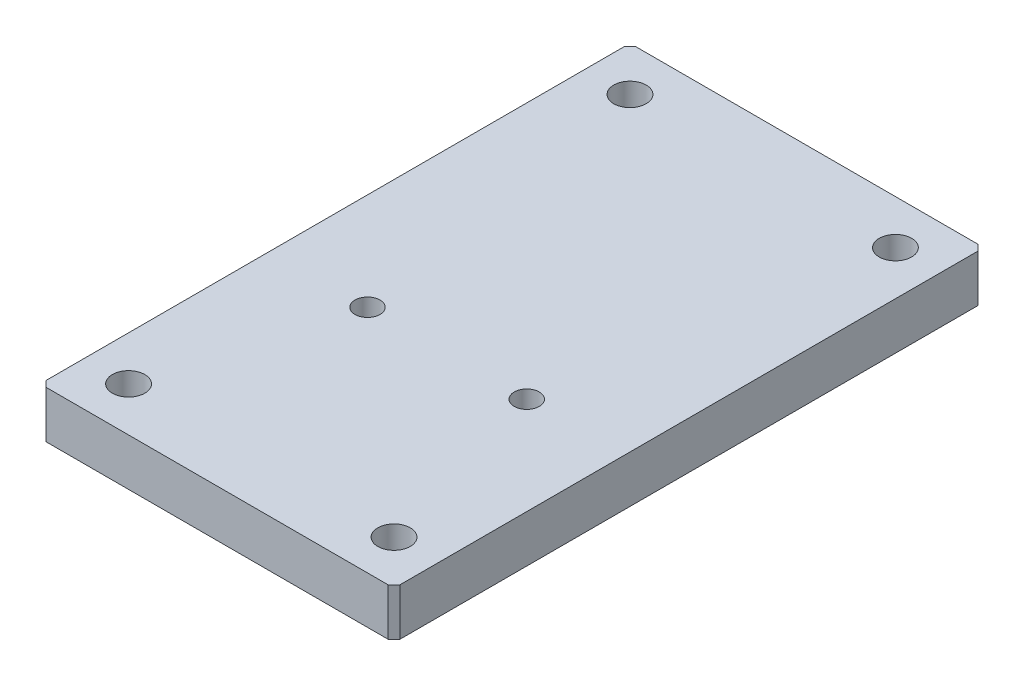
SolidWorks part; units mm, degrees
ref_plane "正面" through (0, 0, 0) normal (0, 0, 1) x (1, 0, 0)
ref_plane "平面" through (0, 0, 0) normal (0, 1, 0) x (1, 0, 0)
ref_plane "右側面" through (0, 0, 0) normal (1, 0, 0) x (0, 0, -1)
sketch "ｽｹｯﾁ1" plane through (0, 0, 0) normal (0, 1, 0) x (1, 0, 0)
  line L1 (-60, 0) -> (60, 0)
  line L2 (-60, 0) -> (-60, 200)
  line L3 (-60, 200) -> (60, 200)
  line L4 (60, 0) -> (60, 200)
  dimension "D1" = 120
  dimension "D2" = 200
extrude "ﾎﾞｽ - 押し出し1" add sketch "ｽｹｯﾁ1" along normal blind 16
sketch "s-取付ねじ1" plane through (0, 0, 0) normal (0, 1, 0) x (1, 0, 0)
  line L0 (0, 0) -> (0, 78) construction
  line L1 (-27, 78) -> (27, 78) construction
  line L2 (-60, 0) -> (60, 0) construction
  dimension "D1" = 54
  dimension "D2" = 78
sketch "s-取付ねじ2" plane through (0, 0, 0) normal (0, 1, 0) x (1, 0, 0)
  line L0 (0, 0) -> (0, 15) construction
  line L1 (-60, 0) -> (60, 0) construction
  line L2 (-45, 15) -> (45, 15) construction
  line L3 (-45, 15) -> (-45, 185) construction
  line L4 (-45, 185) -> (45, 185) construction
  line L5 (45, 15) -> (45, 185) construction
  dimension "D1" = 90
  dimension "D2" = 15
  dimension "D3" = 170
hole_wizard "M10x1.5 ねじ穴1" positions "ｽｹｯﾁ5" profile "ｽｹｯﾁ4" tap size "M10x1.5" standard "Jis"
sketch "ｽｹｯﾁ5" plane through (0, 16, 0) normal (0, 1, 0) x (1, 0, 0)
  point P0 (-27, 78)
  point P3 (27, 78)
sketch "ｽｹｯﾁ4" plane through (-27, 16, -78) normal (1, 0, 0) x (0, 0, 1)
  line L0 (0, 0) -> (0, 16)
  line L1 (0, 16) -> (4.25, 16)
  line L2 (4.25, 16) -> (4.25, 0)
  line L5 (4.25, 0) -> (0, 0)
  line L11 (0, -6.35) -> (0, 107.95) construction
  dimension "次ｻｰﾌｪｽまでのねじ下穴ﾄﾞﾘﾙ直径" = 8.5
  dimension "次ｻｰﾌｪｽまでのねじ下穴ﾄﾞﾘﾙの深さ" = 16
sketch "ｽｹｯﾁ6" plane through (0, 16, 0) normal (0, 1, 0) x (1, 0, 0)
  circle A0 centre (-45, 185) radius 5.5
  circle A1 centre (45, 185) radius 5.5
  circle A2 centre (45, 15) radius 5.5
  circle A3 centre (-45, 15) radius 5.5
  dimension "D1" = 11
extrude "ｶｯﾄ - 押し出し1" cut sketch "ｽｹｯﾁ6" against normal through all
chamfer "面取り1" distance 2 angle 45 4 edges at (-60, 8, -200) (60, 8, -200) (-60, 8, 0) (60, 8, 0)
